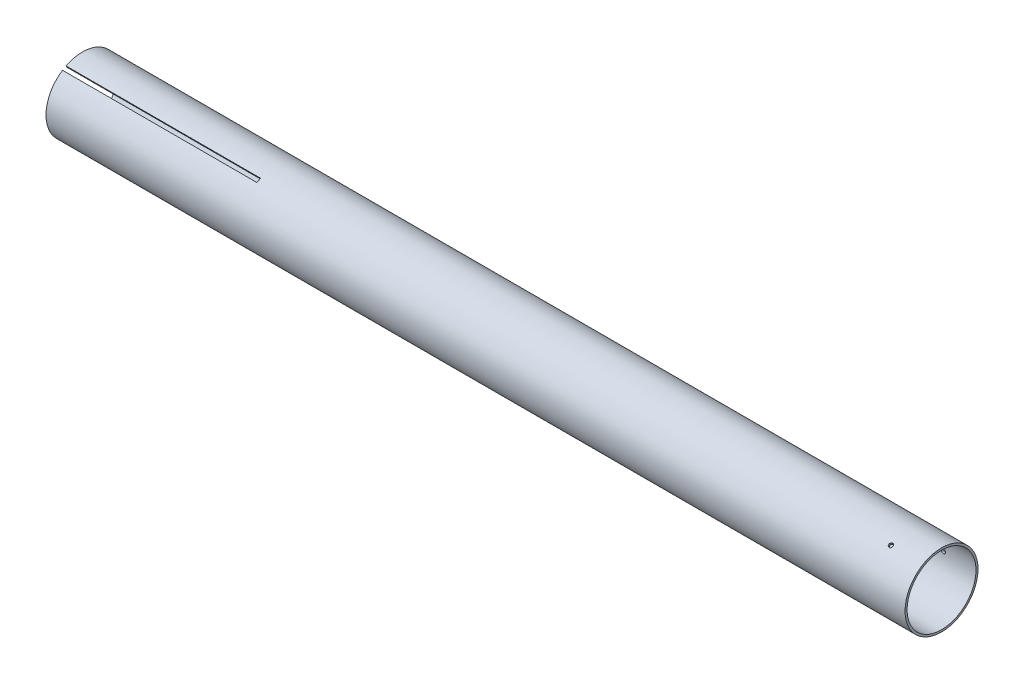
SolidWorks part; units mm, degrees
ref_plane "Front Plane" through (0, 0, 0) normal (0, 0, 1) x (1, 0, 0)
ref_plane "Top Plane" through (0, 0, 0) normal (0, 1, 0) x (1, 0, 0)
ref_plane "Right Plane" through (0, 0, 0) normal (1, 0, 0) x (0, 0, -1)
sketch "Sketch1" plane through (0, 0, 0) normal (1, 0, 0) x (0, 0, -1)
  circle A0 centre (0, 0) radius 28.575
  circle A1 centre (0, 0) radius 26.9875
  dimension "D1" = 57.15
  dimension "D2" = 53.975
extrude "Extrude1" add sketch "Sketch1" along normal blind 673.1
sketch "Sketch2" plane through (0, 0, 0) normal (0, 0, 1) x (1, 0, 0)
  line L0 (0, 0) -> (673.1, 0) construction
  line L1 (673.1, -28.575) -> (673.1, 28.575) construction
ref_plane "Plane1" through (0, 0, 0) normal (0, -0.866, -0.5) x (1, 0, 0)
ref_plane "Plane2" through (0, 0, 0) normal (0, 0.866, -0.5) x (-1, 0, 0)
sketch "Sketch3" plane through (0, 0, 0) normal (0, 0, 1) x (1, 0, 0)
  line L0 (0, 0) -> (673.1, 0) construction
  line L1 (673.1, -28.575) -> (673.1, 28.575) construction
  circle A0 centre (647.7, 0) radius 1.5875
  dimension "D2" = 3.175
  dimension "D1" = 25.4
extrude "Cut-Extrude1" cut sketch "Sketch3" against normal through all
sketch "Sketch4" plane through (0, 0, 0) normal (0, -0.866, -0.5) x (1, 0, 0)
  line L0 (0, 0) -> (673.1, 0) construction
  line L1 (673.1, -28.575) -> (673.1, 28.575) construction
  circle A0 centre (647.7, 0) radius 1.5875
  dimension "D2" = 3.175
  dimension "D1" = 25.4
extrude "Cut-Extrude2" cut sketch "Sketch4" against normal through all
sketch "Sketch5" plane through (0, 0, 0) normal (0, 0.866, -0.5) x (-1, 0, 0)
  line L0 (0, 0) -> (-673.1, 0) construction
  line L1 (-673.1, 28.575) -> (-673.1, -28.575) construction
  circle A0 centre (-647.7, 0) radius 1.5875
  dimension "D2" = 3.175
  dimension "D1" = 25.4
extrude "Cut-Extrude3" cut sketch "Sketch5" against normal through all
sketch "Sketch6" plane through (0, 0, 0) normal (0, 0, 1) x (1, 0, 0)
  line L0 (0, 1.5875) -> (152.4, 1.5875)
  line L1 (0, 28.575) -> (0, -28.575) construction
  line L2 (152.4, 1.5875) -> (152.4, -1.5875)
  line L3 (152.4, -1.5875) -> (0, -1.5875)
  line L4 (0, -1.5875) -> (0, 1.5875)
  dimension "D1" = 3.175
  dimension "D2" = 1.5875
  dimension "D3" = 152.4
extrude "Cut-Extrude4" cut sketch "Sketch6" against normal through all
sketch "Sketch7" plane through (0, 0, 0) normal (0, -0.866, -0.5) x (1, 0, 0)
  line L0 (0, 1.5875) -> (152.4, 1.5875)
  line L1 (0, 28.575) -> (0, -28.575) construction
  line L2 (152.4, 1.5875) -> (152.4, -1.5875)
  line L3 (152.4, -1.5875) -> (0, -1.5875)
  line L4 (0, 26.9875) -> (0, -26.9875) construction
  line L5 (0, -1.5875) -> (0, 1.5875)
  dimension "D1" = 3.175
  dimension "D2" = 1.5875
  dimension "D3" = 152.4
extrude "Cut-Extrude5" cut sketch "Sketch7" against normal through all
sketch "Sketch8" plane through (0, 0, 0) normal (0, 0.866, -0.5) x (-1, 0, 0)
  line L0 (0, 1.5875) -> (-152.4, 1.5875)
  line L1 (0, -23.9147) -> (0, 23.9147) construction
  line L2 (-152.4, 1.5875) -> (-152.4, -1.5875)
  line L3 (-152.4, -1.5875) -> (0, -1.5875)
  line L4 (0, -1.5875) -> (0, 1.5875)
  dimension "D1" = 3.175
  dimension "D2" = 1.5875
  dimension "D3" = 152.4
extrude "Cut-Extrude6" cut sketch "Sketch8" against normal through all
